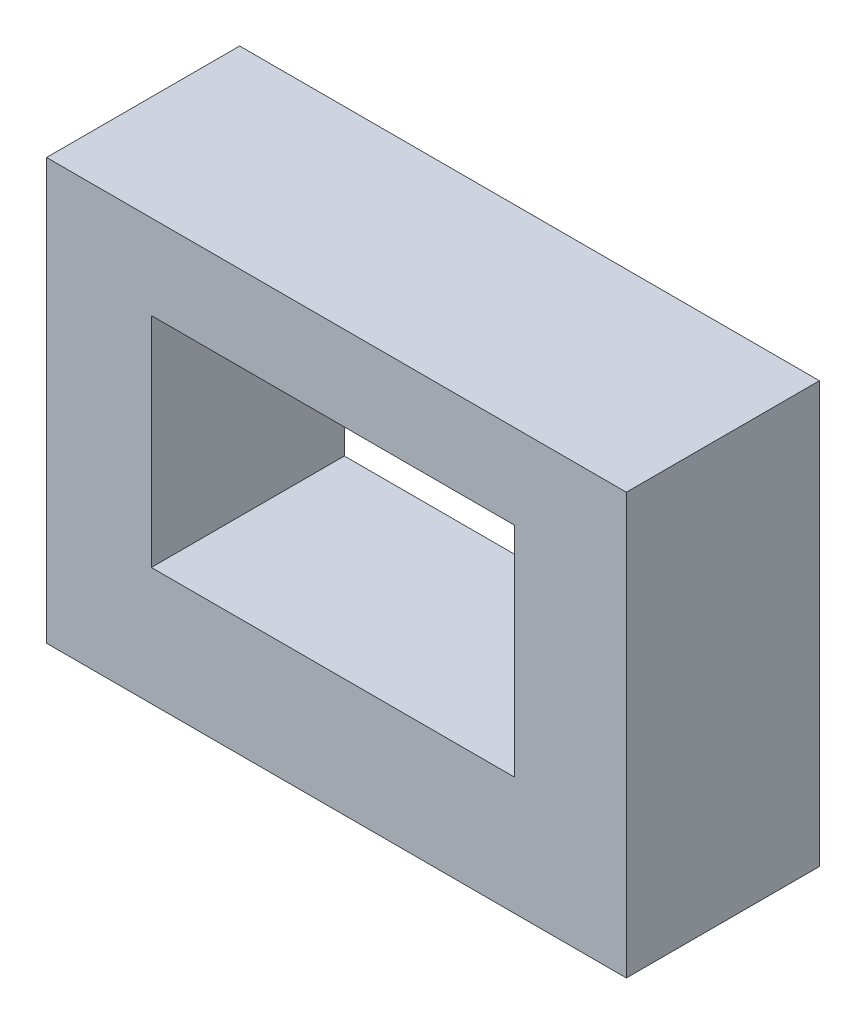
SolidWorks part; units mm, degrees
ref_plane "Front Plane" through (0, 0, 0) normal (0, 0, 1) x (1, 0, 0)
ref_plane "Top Plane" through (0, 0, 0) normal (0, 1, 0) x (1, 0, 0)
ref_plane "Right Plane" through (0, 0, 0) normal (1, 0, 0) x (0, 0, -1)
sketch "Sketch1" plane through (0, 0, 0) normal (0, 0, 1) x (1, 0, 0)
  line L1 (0, 0) -> (49.581, 0)
  line L2 (0, 0) -> (0, 35.978)
  line L3 (0, 35.978) -> (49.581, 35.978)
  line L4 (49.581, 0) -> (49.581, 35.978)
extrude "Extrude1" add sketch "Sketch1" along normal blind 16.51
sketch "Sketch2" plane through (0, 0, 16.51) normal (0, 0, 1) x (1, 0, 0)
  line L1 (8.9572, 28.7502) -> (40.0003, 28.7502)
  line L2 (8.9572, 28.7502) -> (8.9572, 10.093)
  line L3 (8.9572, 10.093) -> (40.0003, 10.093)
  line L4 (40.0003, 28.7502) -> (40.0003, 10.093)
extrude "Cut-Extrude1" cut sketch "Sketch2" against normal through all
